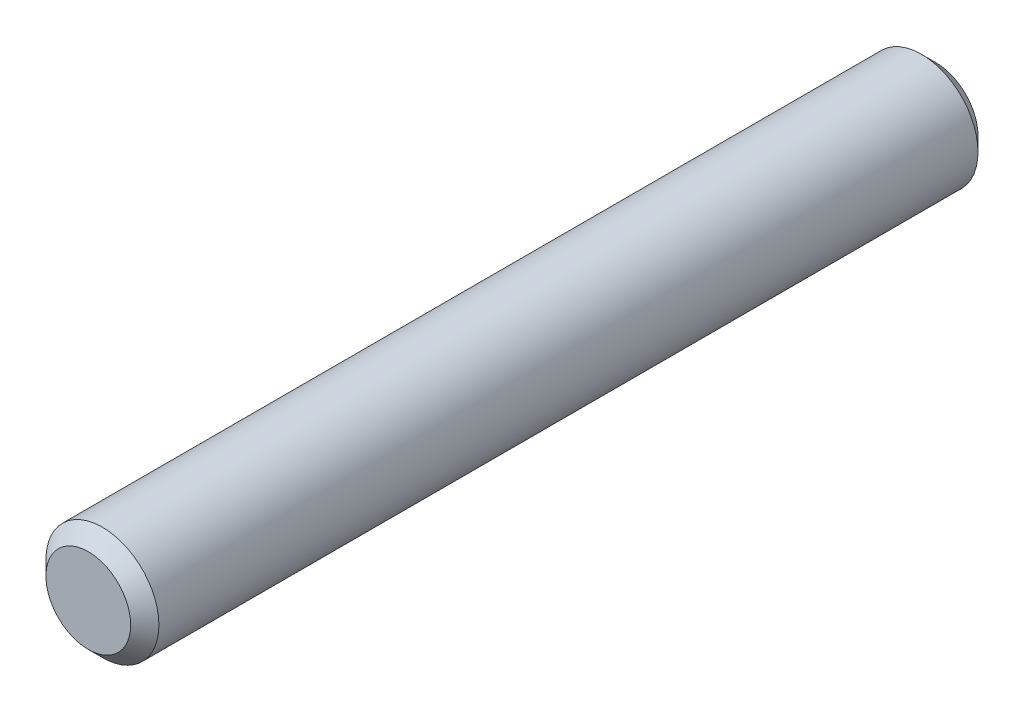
SolidWorks part; units mm, degrees
ref_plane "前视基准面" through (0, 0, 0) normal (0, 0, 1) x (1, 0, 0)
ref_plane "上视基准面" through (0, 0, 0) normal (0, 1, 0) x (1, 0, 0)
ref_plane "右视基准面" through (0, 0, 0) normal (1, 0, 0) x (0, 0, -1)
sketch "草图1" plane through (0, 0, 0) normal (0, 0, 1) x (1, 0, 0)
  circle A0 centre (0, 0) radius 2
extrude "凸台-拉伸1" add sketch "草图1" against normal blind 30
chamfer "倒角1" distance 0.5 angle 45 2 edges at (2, 0, -30) (2, 0, 0)
